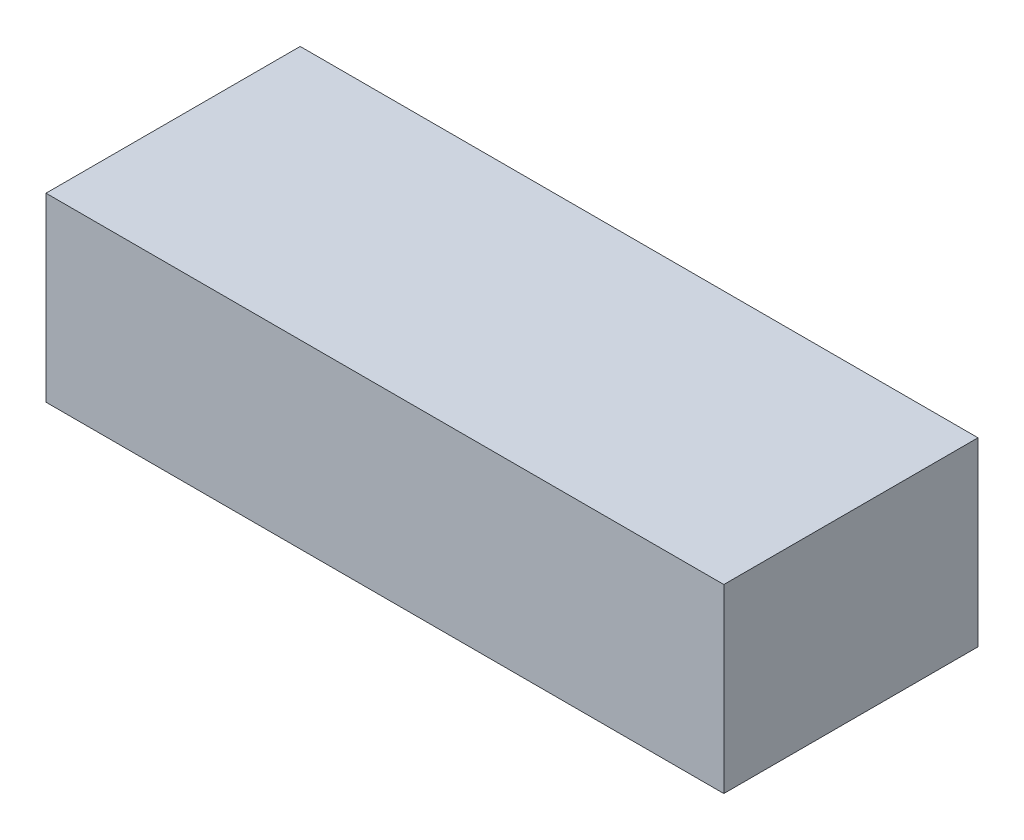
SolidWorks part; units mm, degrees
ref_plane "Plan de face" through (0, 0, 0) normal (0, 0, 1) x (1, 0, 0)
ref_plane "Plan de dessus" through (0, 0, 0) normal (0, 1, 0) x (1, 0, 0)
ref_plane "Plan de droite" through (0, 0, 0) normal (1, 0, 0) x (0, 0, -1)
sketch "Esquisse1" plane through (0, 0, 0) normal (0, 0, 1) x (1, 0, 0)
  line L1 (200, -53.4188) -> (-200, -53.4188)
  line L2 (200, -53.4188) -> (200, 53.4188)
  line L3 (200, 53.4188) -> (-200, 53.4188)
  line L4 (-200, -53.4188) -> (-200, 53.4188)
  line L5 (200, -53.4188) -> (-200, 53.4188) construction
  line L6 (200, 53.4188) -> (-200, -53.4188) construction
  point P0 (0, 0)
  dimension "D1" = 400
  dimension "D2" = 106.8376
extrude "Boss.-Extru.1" add sketch "Esquisse1" along normal mid plane 150
